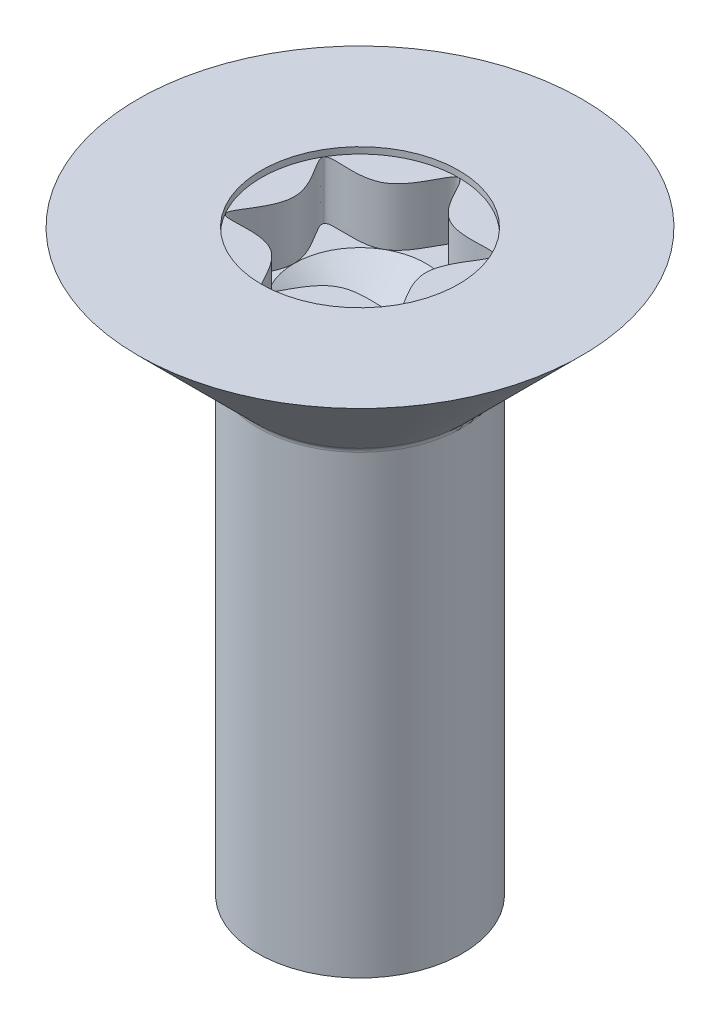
SolidWorks part; units mm, degrees
ref_plane "Front" through (0, 0, 0) normal (0, 0, 1) x (1, 0, 0)
ref_plane "Top" through (0, 0, 0) normal (0, 1, 0) x (1, 0, 0)
ref_plane "Right" through (0, 0, 0) normal (1, 0, 0) x (0, 0, -1)
other "Configuration Table"
sketch "Sketch1" plane through (0, 0, 0) normal (0, 0, 1) x (1, 0, 0)
  line L0 (0, 0) -> (0, 8.8882) construction
  line L1 (0, 8.2) -> (3.15, 8.2)
  line L2 (1.45, 0) -> (1.45, 6.5)
  line L3 (1.45, 6.5) -> (2.55, 6.5) construction
  line L4 (2.55, 6.5) -> (2.55, 5.4) construction
  line L5 (1.45, 0) -> (0, 0)
  line L6 (0, 0) -> (0, 8.2)
  line L7 (3.15, 8.2) -> (1.45, 6.5)
revolve "Body-Revolve" add sketch "Sketch1" angle 360 about L0
sketch "Sketch2" plane through (0, 8.2, 0) normal (0, 1, 0) x (-1, 0, 0)
  line L0 (0, 0) -> (0, -1.54)
  line L1 (0, 0) -> (-0.7, -1.2124)
  circle A0 centre (0, 0) radius 1.4
  circle A1 centre (0, 0) radius 0.9333
  spline S0 degree 3 poles (0.302, -0.523) (0, -1.8385) (-0.302, -0.523) (-1.5922, -0.9193) (-0.6039, 0) (-1.5922, 0.9193) (-0.302, 0.523) (0, 1.8385) (0.302, 0.523) (1.5922, 0.9193) (0.6039, 0) (1.5922, -0.9193) (0.302, -0.523) (0, -1.8385) (-0.302, -0.523) knots -0.25 -0.166667 -0.083333 0 0.083333 0.166667 0.25 0.333333 0.416667 0.5 0.583333 0.666667 0.75 0.833333 0.916667 1 1.083333 1.166667 1.25 only from (0, -1.4) to (0, -1.4)
  point P4 (0, -1.4)
  point P7 (-0.4667, -0.8083)
  point P10 (-1.2124, -0.7)
  point P11 (-1.2124, 0.7)
  point P12 (0, 1.4)
  point P13 (1.2124, 0.7)
  point P14 (1.2124, -0.7)
  point P15 (-0.9333, 0)
  point P16 (-0.4667, 0.8083)
  point P17 (0.4667, 0.8083)
  point P18 (0.9333, 0)
  point P19 (0.4667, -0.8083)
extrude "Recess-Cut-Extrude1" cut sketch "Sketch2" against normal blind 0.91 contours S0
sketch "Sketch3" plane through (0, 8.2, 0) normal (0, 1, 0) x (-1, 0, 0)
  circle A0 centre (0, 0) radius 1.4
extrude "Recess-Cut-Extrude2" cut sketch "Sketch3" against normal blind 0.091
sketch "Sketch4" plane through (0, 0, 0) normal (0, 0, 1) x (1, 0, 0)
  line L0 (0, 7.29) -> (0.9333, 7.29)
  line L1 (1.2177, 7.29) -> (-1.2177, 7.29) construction
  line L2 (0.9333, 7.29) -> (0, 6.67)
  line L3 (0, 0) -> (0, 8.8882) construction
  line L4 (0, 6.67) -> (0, 7.29)
  line L5 (1.4, 8.2) -> (-1.4, 8.2) construction
revolve "Drill-Cut-Revolve" cut sketch "Sketch4" angle 360 about axis through (0, 0, 0) along (0, 1, 0)
fillet "Fillet1" radius 0.1 1 edges at (0, 6.5, -1.45)
sketch "Sketch5" plane through (0, 0, 0) normal (0, 0, 1) x (1, 0, 0)
  line L0 (1.45, 5.4) -> (1.45, 4.7125)
  line L1 (1.45, 0) -> (1.45, 6.4586) construction
  line L2 (1.45, 4.7125) -> (0.8546, 5.0563)
  line L3 (0.8546, 5.0563) -> (1.45, 5.4)
  line L4 (0, 0) -> (0, 8.8882) construction
  line L5 (-1.45, 0) -> (1.45, 0) construction
revolve "ThreadSchematic" [suppressed] cut sketch "Sketch5" angle 360 about axis through (0, 0, 0) along (0, 1, 0)
pattern_linear "ThdSchPat" [suppressed] count 5 spacing 1.1 along (0, 1, 0)
sketch "Sketch6" plane through (0, 0, 0) normal (0, 0, 1) x (1, 0, 0)
  line L0 (0.01, 0) -> (1.45, 0)
  line L1 (-1.45, 0) -> (1.45, 0) construction
  line L2 (1.45, 0) -> (1.45, 2.6)
  line L4 (1.45, 2.6) -> (0.01, 0)
  line L5 (0, 0) -> (0, 8.8882) construction
revolve "TypeC" [suppressed] cut sketch "Sketch6" angle 360 about axis through (0, 0, 0) along (0, 1, 0)
sketch "Sketch7" plane through (0, 0, 0) normal (0, 0, 1) x (1, 0, 0)
  line L0 (1.2293, 0) -> (1.45, 0)
  line L1 (0, 0) -> (0, 8.8882) construction
  line L2 (1.45, 0) -> (1.45, 2.1)
  line L4 (1.45, 2.1) -> (1.2293, 0)
  line L5 (-1.45, 0) -> (1.45, 0) construction
revolve "TypeF" [suppressed] cut sketch "Sketch7" angle 360 about axis through (0, 0, 0) along (0, 1, 0)
sketch "Sketch8" plane through (0, 0, 0) normal (0, 0, 1) x (1, 0, 0)
  line L0 (1.45, -0.09) -> (1.45, 2)
  line L2 (1.45, 2) -> (0.1163, 0.0456)
  line L3 (0.03, 0) -> (0.03, -0.09)
  line L4 (0.03, -0.09) -> (1.45, -0.09)
  line L5 (0, 0) -> (0, 8.8882) construction
  line L9 (-1.45, 0) -> (1.45, 0) construction
  arc A0 (0.1163, 0.0456) -> (0.03, 0) centre (0.03, 0.1045) cw
revolve "TypeR" [suppressed] cut sketch "Sketch8" angle 360 about axis through (0, 0, 0) along (0, 1, 0)
equation "\"thread_gap@Sketch1\" = \"pitch@Sketch1\""
equation "\"D1@ThreadCosmetic\" = \"length@Sketch1\" - \"head_ht@Sketch1\" - \"thread_gap@Sketch1\""
equation "\"D2@ThreadCosmetic\" = \"head_dia@Sketch1\" - \"head_ht@Sketch1\" * 2 - 1.0825 * \"pitch@Sketch1\""
equation "\"D1@Sketch2\" = \"socket_dia@Sketch2\" / 1.5"
equation "\"D3@Sketch2\" = \"socket_dia@Sketch2\" / 2 * 1.1"
equation "\"D1@Sketch3\" = \"socket_dia@Sketch2\""
equation "\"D1@Recess-Cut-Extrude2\" = 0.1 * \"socket-dep@Recess-Cut-Extrude1\""
equation "\"D1@Sketch4\" = 0.9*\"head_ht@Sketch1\""
equation "\"D2@Sketch4\" = \"D1@Sketch2\" / 2"
equation "\"D1@Sketch5\" = \"D2@ThreadCosmetic\" / 2"
equation "\"D2@Sketch5\" = \"D1@ThreadCosmetic\""
equation "\"D3@ThdSchPat\" = \"pitch@Sketch1\""
equation "\"D1@ThdSchPat\" = \"D1@ThreadCosmetic\" / \"D3@ThdSchPat\""
equation "\"D1@Sketch6\" = \"head_dia@Sketch1\" / 2 - \"head_ht@Sketch1\""
equation "\"D2@Sketch7\" = \"head_dia@Sketch1\" / 2 - \"head_ht@Sketch1\""
equation "\"D3@Sketch8\" = \"head_dia@Sketch1\" * 0.5 - \"head_ht@Sketch1\""
equation "\"D4@Sketch8\" = \"end_lengthR@Sketch8\" / 20"
